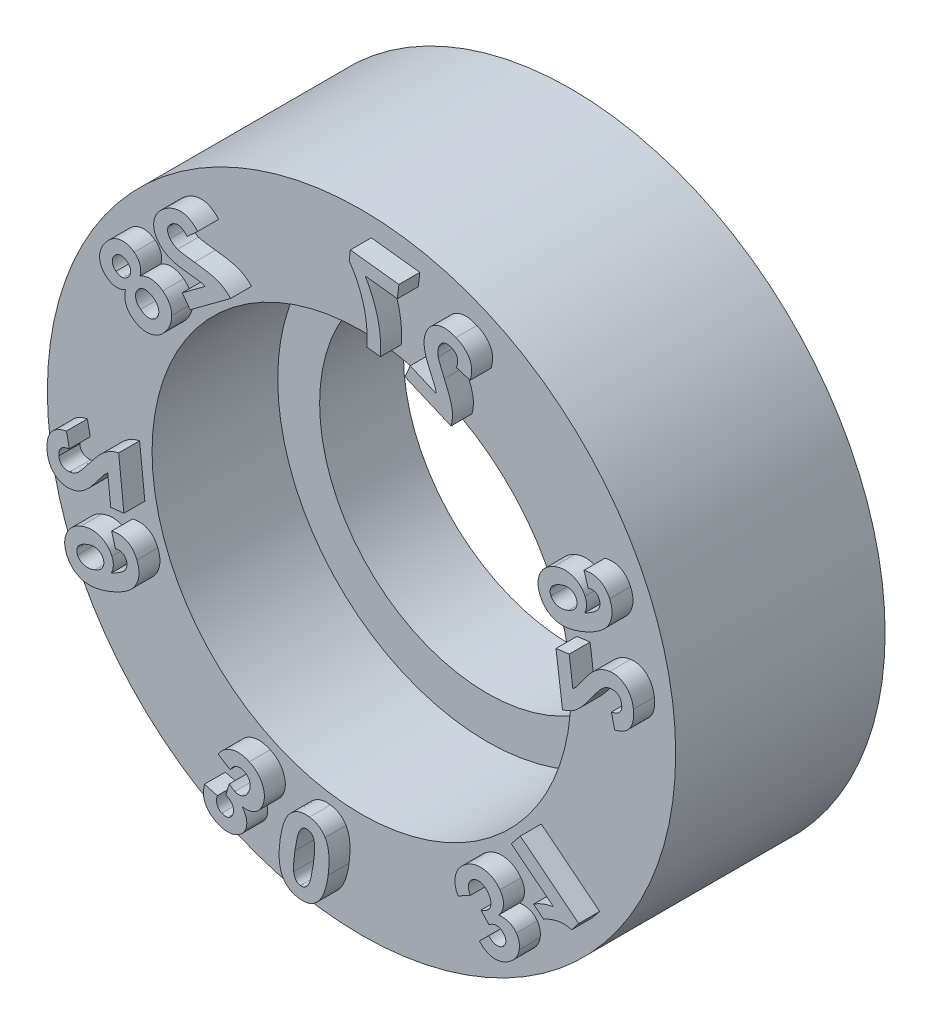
SolidWorks part; units mm, degrees
ref_plane "Front Plane" through (0, 0, 0) normal (0, 0, 1) x (1, 0, 0)
ref_plane "Top Plane" through (0, 0, 0) normal (0, 1, 0) x (1, 0, 0)
ref_plane "Right Plane" through (0, 0, 0) normal (1, 0, 0) x (0, 0, -1)
imported_body "Imported1"
other "DeleteFace2"
sketch "Sketch1" plane through (0, 0, 0) normal (0, 0, 1) x (1, 0, 0)
  line L0 (0, 0) -> (0, 8.7827) construction
  line L1 (0, 0) -> (7.606, 4.3913) construction
  line L2 (0, 0) -> (7.606, -4.3913) construction
  line L3 (0, 0) -> (0, -8.7827) construction
  line L4 (0, 0) -> (-7.606, -4.3913) construction
  line L5 (0, 0) -> (-7.606, 4.3913) construction
  circle A0 centre (0, 0) radius 5.3057 construction
  text T0 "26   27   28   29   30   31" font "Arial" height 1.8
  point P11 (0, 0)
  dimension "D1" = 6
extrude "Boss-Extrude1" add sketch "Sketch1" along normal blind 0.5
